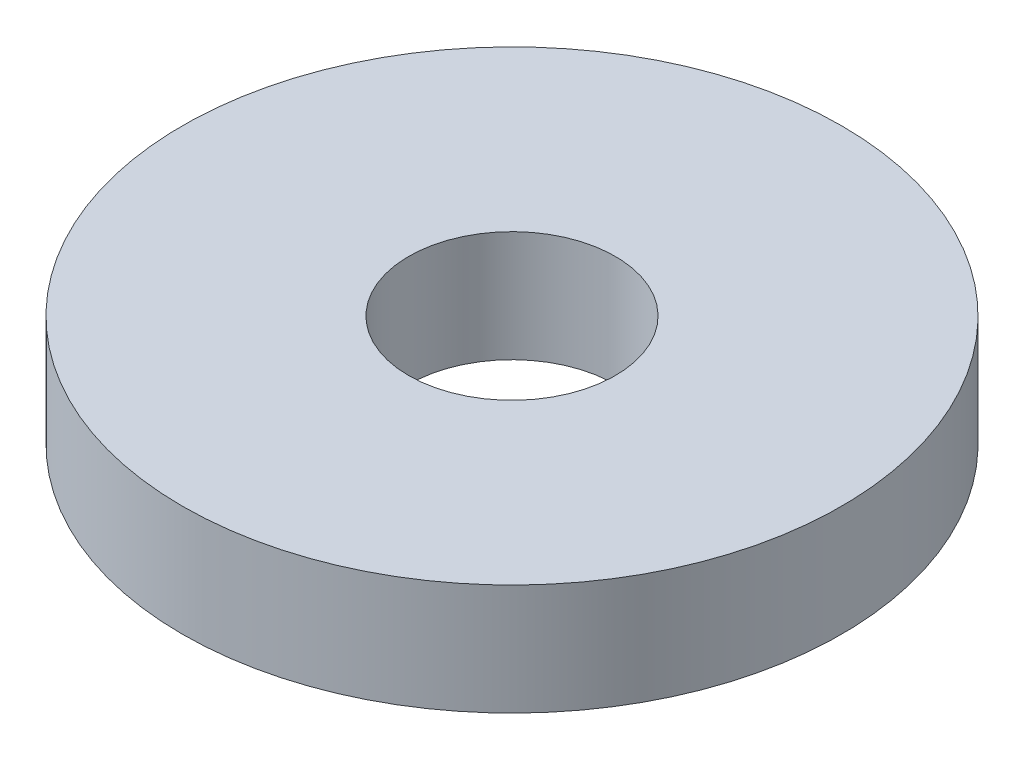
SolidWorks part; units mm, degrees
ref_plane "Front" through (0, 0, 0) normal (0, 0, 1) x (1, 0, 0)
ref_plane "Top" through (0, 0, 0) normal (0, 1, 0) x (1, 0, 0)
ref_plane "Right" through (0, 0, 0) normal (1, 0, 0) x (0, 0, -1)
sketch "Sketch1" plane through (0, 0, 0) normal (0, 1, 0) x (1, 0, 0)
  circle A0 centre (0, 0) radius 2.6416
  circle A1 centre (0, 0) radius 0.828
  dimension "D1" = 1.6561
  dimension "D2" = 5.2832
extrude "Extrude1" add sketch "Sketch1" along normal blind 0.889
